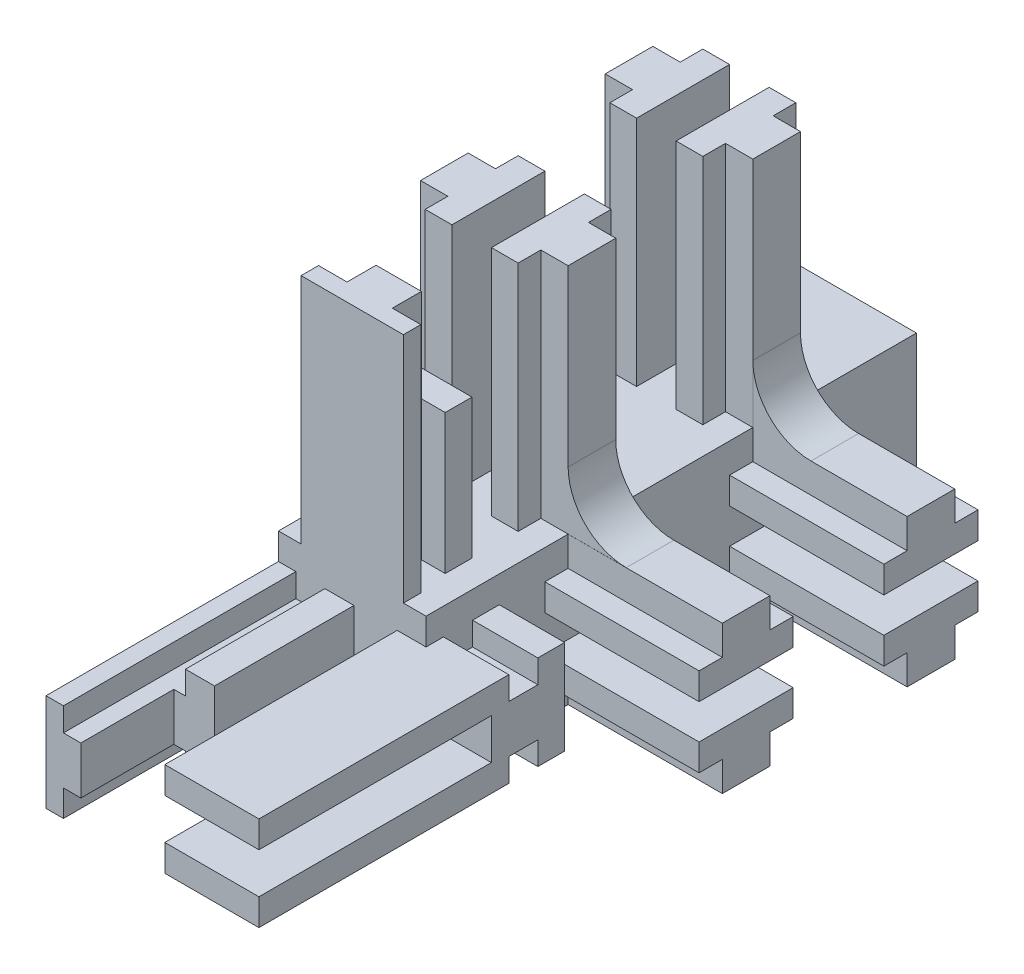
SolidWorks part; units mm, degrees
ref_plane "Front Plane" through (0, 0, 0) normal (0, 0, 1) x (1, 0, 0)
ref_plane "Top Plane" through (0, 0, 0) normal (0, 1, 0) x (1, 0, 0)
ref_plane "Right Plane" through (0, 0, 0) normal (1, 0, 0) x (0, 0, -1)
sketch "Sketch1" plane through (0, 0, 0) normal (0, 0, 1) x (1, 0, 0)
  line L1 (5.4429, 7.3176) -> (-7.2571, 7.3176)
  line L2 (5.4429, 7.3176) -> (5.4429, -5.3824)
  line L3 (5.4429, -5.3824) -> (-7.2571, -5.3824)
  line L4 (-7.2571, 7.3176) -> (-7.2571, -5.3824)
  dimension "D1" = 12.7
  dimension "D2" = 12.7
extrude "Boss-Extrude1" add sketch "Sketch1" along normal blind 44.44
sketch "Sketch4" plane through (0, 7.3176, 0) normal (0, 1, 0) x (1, 0, 0)
  line L0 (1.0429, -42.94) -> (3.4929, -42.94)
  line L2 (5.4429, -22.22) -> (-7.2571, -22.22) construction
  line L3 (5.4429, -44.44) -> (5.4429, 0) construction
  line L4 (1.0429, -1.5) -> (3.0929, -1.5)
  line L5 (-2.6071, -26.165) -> (-2.6071, -34.165)
  line L6 (0.7929, -26.165) -> (0.7929, -34.165)
  line L7 (-7.2571, -16.325) -> (-7.2571, -12.225)
  line L8 (-4.9071, -18.275) -> (-2.6071, -18.275)
  line L9 (-2.6071, -10.275) -> (-4.9071, -10.275)
  line L10 (3.0929, -16.325) -> (3.0929, -18.275)
  line L11 (5.4429, -16.325) -> (5.4429, -12.225)
  line L12 (-4.9071, -34.165) -> (-4.9071, -32.215)
  line L13 (0.7929, -10.275) -> (3.0929, -10.275)
  line L14 (-4.9071, -32.215) -> (-7.2571, -32.215)
  line L15 (3.0929, -16.325) -> (5.4429, -16.325)
  line L16 (-4.9071, -38.14) -> (-4.9071, -40.44)
  line L17 (3.0929, -12.225) -> (5.4429, -12.225)
  line L18 (3.0929, -18.275) -> (0.7929, -18.275)
  line L19 (3.0929, -10.275) -> (3.0929, -12.225)
  line L20 (-4.9071, -26.165) -> (-4.9071, -28.115)
  line L21 (-2.8571, -4) -> (-2.8571, -1.5)
  line L22 (-4.9071, -28.115) -> (-7.2571, -28.115)
  line L23 (1.0429, -4) -> (1.0429, -1.5)
  line L24 (-4.9071, -40.44) -> (-2.8571, -40.44)
  line L25 (-4.9071, -6.3) -> (3.0929, -6.3)
  line L26 (3.0929, -4) -> (3.0929, -6.3)
  line L27 (3.0929, -4) -> (1.0429, -4)
  line L28 (-4.9071, -4) -> (-2.8571, -4)
  line L29 (-4.9071, -16.325) -> (-7.2571, -16.325)
  line L30 (-4.9071, -18.275) -> (-4.9071, -16.325)
  line L31 (-4.9071, -6.3) -> (-4.9071, -4)
  line L32 (3.0929, -40.44) -> (1.0429, -40.44)
  line L33 (3.0929, -40.44) -> (3.0929, -38.14)
  line L34 (-4.9071, -38.14) -> (3.0929, -38.14)
  line L35 (1.0429, -40.44) -> (1.0429, -42.94)
  line L36 (-2.8571, -40.44) -> (-2.8571, -42.94)
  line L37 (3.0929, -34.165) -> (3.0929, -32.215)
  line L38 (-4.9071, -12.225) -> (-7.2571, -12.225)
  line L39 (-7.2571, -44.44) -> (-7.2571, 0) construction
  line L40 (-4.9071, -10.275) -> (-4.9071, -12.225)
  line L41 (0.7929, -18.275) -> (0.7929, -10.275)
  line L42 (3.0929, -26.165) -> (0.7929, -26.165)
  line L43 (3.0929, -32.215) -> (5.4429, -32.215)
  line L44 (-2.6071, -18.275) -> (-2.6071, -10.275)
  line L45 (3.0929, -28.115) -> (5.4429, -28.115)
  line L46 (3.4929, -42.94) -> (3.4929, -44.44)
  line L47 (0.7929, -34.165) -> (3.0929, -34.165)
  line L48 (5.4429, -28.115) -> (5.4429, -32.215)
  line L49 (3.0929, -28.115) -> (3.0929, -26.165)
  line L50 (-2.6071, -34.165) -> (-4.9071, -34.165)
  line L51 (-4.9071, -26.165) -> (-2.6071, -26.165)
  line L52 (-7.2571, -28.115) -> (-7.2571, -32.215)
  line L53 (5.4429, -44.44) -> (-7.2571, -44.44) construction
  line L54 (3.4929, -44.44) -> (-5.3071, -44.44)
  line L55 (-5.3071, -44.44) -> (-5.3071, -42.94)
  line L56 (-5.3071, -42.94) -> (-2.8571, -42.94)
  line L57 (3.0929, -1.5) -> (3.0929, 0)
  line L58 (5.4429, 0) -> (-7.2571, 0) construction
  line L59 (3.0929, 0) -> (-4.9071, 0)
  line L60 (-4.9071, 0) -> (-4.9071, -1.5)
  line L61 (-4.9071, -1.5) -> (-2.8571, -1.5)
  point P0 (-0.9071, 0)
  point P68 (-0.9071, -6.3)
  dimension "D5" = 8
  dimension "D6" = 2.35
  dimension "D7" = 3.975
  dimension "D8" = 2.3
  dimension "D9" = 8
  dimension "D11" = 1.5
  dimension "D12" = 4.1
  dimension "D19" = 2.35
  dimension "D20" = 2.3
  dimension "D23" = 2.3
  dimension "D24" = 8
  dimension "D25" = 4.1
  dimension "D30" = 2.5
extrude "Boss-Extrude3" add sketch "Sketch4" along normal blind 20
sketch "Sketch5" plane through (-7.2571, 0, 0) normal (-1, 0, 0) x (0, 0, 1)
  line L0 (1.5, 3.0176) -> (1.5, 5.0176)
  line L1 (42.94, 3.0176) -> (42.94, 5.0176)
  line L2 (1.5, 5.0176) -> (0, 5.0176)
  line L3 (0, 7.3176) -> (0, -5.3824) construction
  line L4 (0, 5.0176) -> (0, -3.0824)
  line L5 (0, -3.0824) -> (1.5, -3.0824)
  line L6 (16.32, -5.3824) -> (12.22, -5.3824)
  line L7 (18.32, -2.8324) -> (18.32, -0.5324)
  line L8 (10.22, -0.5324) -> (10.22, -2.8324)
  line L9 (16.32, 4.7676) -> (18.32, 4.7676)
  line L10 (16.32, 7.3176) -> (12.22, 7.3176)
  line L11 (1.5, -3.0824) -> (1.5, -1.0824)
  line L12 (10.22, 2.4676) -> (10.22, 4.7676)
  line L13 (42.94, 5.0176) -> (44.44, 5.0176)
  line L14 (16.32, 4.7676) -> (16.32, 7.3176)
  line L15 (44.44, 7.3176) -> (44.44, -5.3824) construction
  line L16 (12.22, 4.7676) -> (12.22, 7.3176)
  line L17 (18.32, 4.7676) -> (18.32, 2.4676)
  line L18 (10.22, 4.7676) -> (12.22, 4.7676)
  line L19 (44.44, 5.0176) -> (44.44, -3.0824)
  line L20 (4, -1.0824) -> (1.5, -1.0824)
  line L21 (44.44, -3.0824) -> (42.94, -3.0824)
  line L22 (4, 3.0176) -> (1.5, 3.0176)
  line L23 (42.94, -3.0824) -> (42.94, -1.0824)
  line L24 (6.3, -3.0824) -> (6.3, 5.0176)
  line L25 (4, 5.0176) -> (6.3, 5.0176)
  line L26 (4, 5.0176) -> (4, 3.0176)
  line L27 (4, -3.0824) -> (4, -1.0824)
  line L28 (16.32, -2.8324) -> (16.32, -5.3824)
  line L29 (18.32, -2.8324) -> (16.32, -2.8324)
  line L30 (6.3, -3.0824) -> (4, -3.0824)
  line L31 (44.44, 7.3176) -> (32.215, 7.3176) construction
  line L32 (4, 27.3176) -> (4, 7.3176) construction
  line L37 (12.22, -2.8324) -> (12.22, -5.3824)
  line L38 (10.22, -2.8324) -> (12.22, -2.8324)
  line L39 (18.32, 2.4676) -> (10.22, 2.4676)
  line L42 (18.32, -0.5324) -> (10.22, -0.5324)
  line L54 (28.115, 7.3176) -> (16.325, 7.3176) construction
  line L55 (22.22, 7.3176) -> (22.22, -5.3824) construction
  line L56 (44.44, -5.3824) -> (0, -5.3824) construction
  line L63 (26.12, -0.5324) -> (34.22, -0.5324)
  line L66 (26.12, 2.4676) -> (34.22, 2.4676)
  line L67 (34.22, -2.8324) -> (32.22, -2.8324)
  line L68 (32.22, -2.8324) -> (32.22, -5.3824)
  line L75 (38.14, -3.0824) -> (40.44, -3.0824)
  line L76 (26.12, -2.8324) -> (28.12, -2.8324)
  line L77 (28.12, -2.8324) -> (28.12, -5.3824)
  line L78 (40.44, -3.0824) -> (40.44, -1.0824)
  line L79 (40.44, 5.0176) -> (40.44, 3.0176)
  line L80 (40.44, 5.0176) -> (38.14, 5.0176)
  line L81 (38.14, -3.0824) -> (38.14, 5.0176)
  line L83 (40.44, 3.0176) -> (42.94, 3.0176)
  line L85 (40.44, -1.0824) -> (42.94, -1.0824)
  line L87 (34.22, 4.7676) -> (32.22, 4.7676)
  line L88 (26.12, 4.7676) -> (26.12, 2.4676)
  line L89 (32.22, 4.7676) -> (32.22, 7.3176)
  line L91 (28.12, 4.7676) -> (28.12, 7.3176)
  line L93 (34.22, 2.4676) -> (34.22, 4.7676)
  line L95 (28.12, 7.3176) -> (32.22, 7.3176)
  line L96 (28.12, 4.7676) -> (26.12, 4.7676)
  line L97 (34.22, -0.5324) -> (34.22, -2.8324)
  line L98 (26.12, -2.8324) -> (26.12, -0.5324)
  line L99 (28.12, -5.3824) -> (32.22, -5.3824)
  dimension "D1" = 4.1
  dimension "D3" = 3
  dimension "D4" = 2.55
  dimension "D5" = 1.5
  dimension "D6" = 2.3
  dimension "D7" = 8.1
  dimension "D8" = 2.3
  dimension "D9" = 3.9
  dimension "D10" = 8.1
  dimension "D11" = 4.1
  dimension "D12" = 4.1
  dimension "D13" = 2.3
  dimension "D16" = 8.1
  dimension "D19" = 2.3
  dimension "D21" = 2.5
extrude "Boss-Extrude4" add sketch "Sketch5" along normal blind 31.74
sketch "Sketch6" plane through (0, 0, 0) normal (0, 0, -1) x (-1, 0, 0)
  line L0 (-6.6534, 2.2662) -> (-8.5879, 2.2662) construction
  line L2 (-5.4429, -5.3824) -> (-5.4429, 7.3176) construction
  line L14 (1.8572, 5.4581) -> (-1.4428, 5.4581)
  line L22 (-1.4428, 5.4581) -> (-1.4429, 3.3581)
  line L30 (-1.4428, -3.5228) -> (-1.4429, -1.4228)
  line L31 (-1.4428, -3.5228) -> (1.8572, -3.5228)
  line L32 (1.8572, 5.4581) -> (1.8572, -3.5228)
  line L33 (-1.4429, -1.4228) -> (-3.4429, -1.4324)
  line L34 (-1.4429, 3.3581) -> (-3.4429, 3.3676)
  line L50 (-3.4429, -1.4324) -> (-3.4429, 3.3676)
  point P2 (-3.4429, 0.9676)
  point P8 (-5.4429, 0.9676)
  dimension "D1" = 2
  dimension "D2" = 4.8
  dimension "D3" = 3.3
  dimension "D4" = 3.3
extrude "Boss-Extrude5" add sketch "Sketch6" along normal blind 20
sketch "Sketch7" [suppressed] plane through (3.4429, 0, 0) normal (1, 0, 0) x (0, 0, -1)
  line L0 (-32.565, 27.3176) -> (-27.965, 27.3176) construction
  line L1 (-16.475, 27.3176) -> (-11.875, 27.3176) construction
  line L2 (20, 3.3676) -> (20, -1.4324) construction
  circle A0 centre (16, 0.9676) radius 2.1
  circle A1 centre (6, 0.9676) radius 2.1
  circle A2 centre (-14.175, 23.3176) radius 2.1
  circle A3 centre (-14.175, 13.3176) radius 2.1
  circle A4 centre (-30.265, 23.3176) radius 2.1
  circle A5 centre (-30.265, 13.3176) radius 2.1
  dimension "D1" = 4.2
  dimension "D2" = 4.2
  dimension "D3" = 4.2
  dimension "D4" = 4.2
  dimension "D5" = 4.2
  dimension "D6" = 4.2
  dimension "D7" = 4
  dimension "D8" = 4
  dimension "D9" = 4
  dimension "D10" = 10
  dimension "D11" = 10
  dimension "D12" = 10
extrude "Cut-Extrude1" [suppressed] cut sketch "Sketch7" against normal through all both and the other way through all
sketch "Sketch8" plane through (0, 7.3176, 0) normal (0, 1, 0) x (1, 0, 0)
  line L0 (-38.9971, -16.32) -> (-38.9971, -12.22) construction
  line L2 (-38.9971, -32.22) -> (-38.9971, -28.12) construction
  circle A0 centre (-30.9971, -14.27) radius 2.1
  circle A1 centre (-20.9971, -14.27) radius 2.1
  circle A2 centre (-30.9971, -30.17) radius 2.1
  circle A3 centre (-20.9971, -30.17) radius 2.1
  point P5 (-38.9971, -14.27)
  point P16 (-38.9971, -30.17)
  dimension "D1" = 4.2
  dimension "D4" = 4.2
  dimension "D5" = 4.2
  dimension "D6" = 10
  dimension "D3" = 4.2
  dimension "D2" = 8
  dimension "D7" = 8
  dimension "D8" = 10
extrude "Cut-Extrude2" [suppressed] cut sketch "Sketch8" against normal through all both and the other way through all
sketch "Sketch9" plane through (5.4429, 0, 0) normal (1, 0, 0) x (0, 0, -1)
  line L1 (0, 5.4581) -> (20, 5.4581)
  line L2 (0, 5.4581) -> (0, -3.5228)
  line L3 (0, -3.5228) -> (20, -3.5228)
  line L4 (20, 5.4581) -> (20, -3.5228)
extrude "Cut-Extrude3" cut sketch "Sketch9" against normal through all
sketch "Sketch11" plane through (0, 0, 44.44) normal (0, 0, 1) x (1, 0, 0)
  line L0 (4.6313, 1.3536) -> (6.5657, 1.3536) construction
  line L1 (3.9429, 3.0176) -> (3.9429, 5.0397)
  line L2 (-16.7771, 7.3036) -> (-16.7771, -5.3964) construction
  line L3 (-12.8771, -0.7824) -> (-4.7771, -0.7824)
  line L4 (-12.8771, 2.7176) -> (-4.7771, 2.7176)
  line L5 (-38.9971, -3.0824) -> (-7.2571, -3.0824) construction
  line L6 (-20.6771, -3.0824) -> (-20.6771, -0.7824)
  line L7 (-28.7771, -0.7824) -> (-28.7771, -3.0824)
  line L8 (-28.7771, -3.0824) -> (-20.6771, -3.0824)
  line L9 (-28.7771, 5.0176) -> (-20.6771, 5.0176)
  line L11 (-28.7771, 2.7176) -> (-28.7771, 5.0176)
  line L13 (-12.8771, 5.0176) -> (-4.7771, 5.0176)
  line L14 (-1.0571, -3.0824) -> (1.4429, -3.0824)
  line L15 (-12.8771, -3.0824) -> (-4.7771, -3.0824)
  line L16 (-20.6771, 5.0176) -> (-20.6771, 2.7176)
  line L17 (-38.9971, 5.0176) -> (-7.2571, 5.0176) construction
  line L19 (-34.9971, -1.0824) -> (-37.4971, -1.0824)
  line L20 (-37.4971, 3.0176) -> (-37.4971, 5.0176)
  line L21 (-34.9971, 3.0176) -> (-37.4971, 3.0176)
  line L22 (1.4429, -3.0824) -> (1.4429, -1.0824)
  line L23 (-32.4971, -3.0824) -> (-32.4971, 5.0176)
  line L24 (-34.9971, 5.0176) -> (-32.4971, 5.0176)
  line L25 (-34.9971, 5.0176) -> (-34.9971, 3.0176)
  line L26 (-34.9971, -3.0824) -> (-34.9971, -1.0824)
  line L27 (-37.4971, 5.0176) -> (-38.9971, 5.0176)
  line L28 (-38.9971, 5.0176) -> (-38.9971, -3.0824)
  line L29 (-32.4971, -3.0824) -> (-34.9971, -3.0824)
  line L30 (1.4429, 5.0176) -> (1.4429, 3.0176)
  line L31 (1.4429, 5.0176) -> (-1.0571, 5.0176)
  line L32 (-1.0571, -3.0824) -> (-1.0571, 5.0176)
  line L33 (1.4429, 3.0176) -> (3.9429, 3.0176)
  line L34 (1.4429, -1.0824) -> (3.9429, -1.0824)
  line L35 (-38.9971, -3.0824) -> (-37.4971, -3.0824)
  line L36 (-37.4971, -3.0824) -> (-37.4971, -1.0824)
  line L37 (3.9429, 5.0397) -> (5.4429, 5.0397)
  line L38 (-20.6771, 2.7176) -> (-28.7771, 2.7176)
  line L39 (-12.8771, 5.0176) -> (-12.8771, 2.7176)
  line L40 (5.4429, 5.0397) -> (5.4429, -3.3603)
  line L41 (-20.6771, -0.7824) -> (-28.7771, -0.7824)
  line L42 (5.4429, -3.3603) -> (3.9429, -3.3603)
  line L44 (-4.7771, 2.7176) -> (-4.7771, 5.0176)
  line L45 (3.9429, -3.3603) -> (3.9429, -1.0824)
  line L47 (-4.7771, -0.7824) -> (-4.7771, -3.0824)
  line L48 (-12.8771, -3.0824) -> (-12.8771, -0.7824)
  line L49 (5.4429, -5.3824) -> (5.4429, 7.3176) construction
  point P0 (-16.7771, 0.9536)
  dimension "D3" = 2.3
  dimension "D4" = 3.5
  dimension "D6" = 3.9
  dimension "D7" = 8.1
  dimension "D8" = 2.3
  dimension "D9" = 1.5
  dimension "D10" = 8.1
  dimension "D11" = 1.5
  dimension "D12" = 22.22
  dimension "D13" = 22.22
  dimension "D15" = 2
  dimension "D16" = 8.1
  dimension "D17" = 1.5
  dimension "D19" = 2.5
  dimension "D20" = 2.5
  dimension "D21" = 2.5
extrude "Boss-Extrude6" add sketch "Sketch11" along normal blind 20
sketch "Sketch14" plane through (-38.9971, 0, 0) normal (-1, 0, 0) x (0, 0, 1)
  line L0 (44.44, 7.3176) -> (32.22, 7.3176) construction
  line L1 (42.67, 7.3176) -> (0, 7.3176)
  line L2 (42.67, 7.3176) -> (42.67, -5.3824)
  line L3 (42.67, -5.3824) -> (0, -5.3824)
  line L4 (0, 7.3176) -> (0, -5.3824)
extrude "Cut-Extrude4" [suppressed] cut sketch "Sketch14" against normal through all
sketch "Sketch15" plane through (0, 5.0176, 0) normal (0, 1, 0) x (1, 0, 0)
  line L0 (-4.7771, -64.44) -> (-12.8771, -64.44) construction
  line L1 (-20.6771, -64.44) -> (-28.7771, -64.44) construction
  circle A0 centre (-8.8271, -60.44) radius 2.1
  circle A1 centre (-8.8271, -50.44) radius 2.1
  circle A2 centre (-24.7271, -60.44) radius 2.1
  circle A3 centre (-24.7271, -50.44) radius 2.1
  point P12 (-24.7271, -64.44)
  point P13 (-8.8271, -64.44)
  dimension "D1" = 4.2
  dimension "D2" = 4.2
  dimension "D3" = 4.2
  dimension "D4" = 4.2
  dimension "D5" = 4
  dimension "D6" = 10
  dimension "D7" = 4
  dimension "D8" = 10
extrude "Cut-Extrude5" [suppressed] cut sketch "Sketch15" against normal blind 30
sketch "Sketch17" plane through (-7.2571, 0, 0) normal (-1, 0, 0) x (0, 0, 1)
  line L0 (12.225, 27.3176) -> (16.325, 27.3176) construction
  line L1 (28.115, 27.3176) -> (32.215, 27.3176) construction
  circle A0 centre (14.275, 23.3176) radius 2.1
  circle A1 centre (14.275, 13.3176) radius 2.1
  circle A2 centre (30.165, 23.3176) radius 2.1
  circle A3 centre (30.165, 13.3176) radius 2.1
  point P13 (30.165, 27.3176)
  point P14 (14.275, 27.3176)
  dimension "D1" = 4.2
  dimension "D2" = 4.2
  dimension "D3" = 4.2
  dimension "D4" = 4.2
  dimension "D5" = 4
  dimension "D6" = 4
  dimension "D7" = 10
  dimension "D8" = 10
extrude "Cut-Extrude6" [suppressed] cut sketch "Sketch17" against normal blind 30
sketch "Sketch18" plane through (-38.9971, 0, 0) normal (-1, 0, 0) x (0, 0, 1)
  line L0 (4, -3.0824) -> (6.3, -3.0824) construction
  line L1 (3, 5.0176) -> (6.3, 5.0176)
  line L2 (3, 5.0176) -> (3, -3.0824)
  line L3 (3, -3.0824) -> (6.3, -3.0824)
  line L4 (6.3, 5.0176) -> (6.3, -3.0824)
  line L7 (1.5, 3.0176) -> (1.5, 5.0176) construction
  dimension "D1" = 1.5
extrude "Cut-Extrude7" cut sketch "Sketch18" against normal blind 8
sketch "Sketch19" plane through (0, 27.3176, 0) normal (0, 1, 0) x (1, 0, 0)
  line L1 (3.0929, -4) -> (-4.9071, -4)
  line L2 (3.0929, -4) -> (3.0929, -6.3)
  line L3 (3.0929, -6.3) -> (-4.9071, -6.3)
  line L4 (-4.9071, -4) -> (-4.9071, -6.3)
  line L5 (3.0929, -38.14) -> (-4.9071, -38.14)
  line L6 (3.0929, -38.14) -> (3.0929, -40.44)
  line L7 (3.0929, -40.44) -> (-4.9071, -40.44)
  line L8 (-4.9071, -38.14) -> (-4.9071, -40.44)
extrude "Cut-Extrude8" cut sketch "Sketch19" against normal blind 8
sketch "Sketch20" plane through (-38.9971, 0, 0) normal (-1, 0, 0) x (0, 0, 1)
  line L0 (42.94, -1.0824) -> (42.94, -3.3603)
  line L1 (42.94, 5.0176) -> (44.44, 5.0176)
  line L2 (42.94, 5.0176) -> (42.94, 3.1397)
  line L3 (42.94, -3.3603) -> (44.44, -3.3603)
  line L4 (44.44, 5.0176) -> (44.44, -3.3603)
  line L5 (41.44, 3.1397) -> (42.94, 3.1397)
  line L6 (41.44, 3.1397) -> (41.44, -1.0824)
  line L7 (41.44, -1.0824) -> (42.94, -1.0824)
  dimension "D1" = 1.5
extrude "Boss-Extrude7" [suppressed] add sketch "Sketch20" along normal blind 8
sketch "Sketch21" plane through (0, 0, 64.44) normal (0, 0, 1) x (1, 0, 0)
  line L0 (-35.9971, 3.2397) -> (-36.0266, -3.378)
  line L1 (-32.4971, 5.0176) -> (-35.9971, 5.0176)
  line L2 (-32.4971, 5.0176) -> (-32.4971, -3.378)
  line L3 (-32.4971, -3.378) -> (-36.0266, -3.378)
  line L4 (-35.9971, 5.0176) -> (-35.9971, 3.2397)
  line L5 (2.4429, 5.0397) -> (-1.0571, 5.0397)
  line L6 (2.4429, 5.0397) -> (2.4429, -1.5603)
  line L7 (2.1429, -3.0824) -> (-1.0571, -3.0824)
  line L8 (-1.0571, 5.0397) -> (-1.0571, -3.0824)
  line L10 (3.9429, 5.0397) -> (3.9429, 3.0176) construction
  line L11 (-37.4971, 3.0176) -> (-37.4971, 5.0176) construction
  line L12 (2.4429, -1.5603) -> (2.1429, -3.0824)
  dimension "D1" = 1.5
  dimension "D2" = 1.5
  dimension "D3" = 1.5
extrude "Cut-Extrude9" cut sketch "Sketch21" against normal blind 8
hole_wizard "CSK for M2.5 Cross Recess Flat Head Screw1" positions "Sketch22" profile "Sketch24" countersink size "M2.5" standard "IS"
sketch "Sketch22" plane through (0, 0, 0) normal (0, 0, -1) x (-1, 0, 0)
  line L0 (-3.0929, 27.3176) -> (4.9071, 27.3176) construction
  line L1 (38.9971, 5.0176) -> (38.9971, -3.0824) construction
  point P0 (33.9971, 0.8397)
  point P6 (0.9071, 22.3176)
  dimension "D1" = 5
  dimension "D2" = 5
sketch "Sketch24" plane through (-33.9971, 0.8397, 0) normal (1, 0, 0) x (0, 1, 0)
  line L0 (0, 0) -> (0, 5.9313)
  line L1 (0, 5.9313) -> (1.55, 5)
  line L2 (1.55, 5) -> (1.55, 1.2)
  line L3 (1.55, 1.2) -> (2.75, 0)
  line L5 (2.75, 0) -> (0, 0)
  line L6 (-1.55, 1.2) -> (-2.75, 0) construction
  line L10 (0, 5.9313) -> (-1.55, 5) construction
  line L11 (0, -6.35) -> (0, 107.95) construction
  dimension "Hole Dia." = 3.1
  dimension "Hole Depth" = 5
  dimension "Near C'Sink Dia." = 5.5
  dimension "Near C'Sink Angle" = 90
  dimension "Drill Angle" = 118
hole_wizard "CSK for M2.5 Cross Recess Flat Head Screw2" positions "Sketch25" profile "Sketch26" countersink size "M2.5" standard "IS"
sketch "Sketch25" [suppressed] plane through (0, 0, 44.44) normal (0, 0, 1) x (1, 0, 0)
  line L0 (-46.9971, -3.3603) -> (-46.9971, 5.0397) construction
  line L1 (-5.3071, 27.3176) -> (3.4929, 27.3176) construction
  point P0 (-41.9971, 0.8397)
  point P2 (-0.9071, 22.3176)
  dimension "D1" = 5
  dimension "D2" = 5
sketch "Sketch26" plane through (-41.9971, 0.8397, 44.44) normal (1, 0, 0) x (0, -1, 0)
  line L0 (0, 0) -> (0, 5.9313)
  line L1 (0, 5.9313) -> (1.55, 5)
  line L2 (1.55, 5) -> (1.55, 1.2)
  line L3 (1.55, 1.2) -> (2.75, 0)
  line L5 (2.75, 0) -> (0, 0)
  line L6 (-1.55, 1.2) -> (-2.75, 0) construction
  line L10 (0, 5.9313) -> (-1.55, 5) construction
  line L11 (0, -6.35) -> (0, 107.95) construction
  dimension "Hole Dia." = 3.1
  dimension "Hole Depth" = 5
  dimension "Near C'Sink Dia." = 5.5
  dimension "Near C'Sink Angle" = 90
  dimension "Drill Angle" = 118
hole_wizard "CSK for M2.5 Cross Recess Flat Head Screw3" positions "Sketch27" profile "Sketch28" countersink size "M2.5" standard "IS"
sketch "Sketch27" plane through (5.4429, 0, 0) normal (1, 0, 0) x (0, 0, -1)
  line L0 (-64.44, -3.3603) -> (-64.44, 5.0397) construction
  point P0 (-59.44, 0.8397)
  dimension "D1" = 5
sketch "Sketch28" plane through (5.4429, 0.8397, 59.44) normal (0, 1, 0) x (0, 0, -1)
  line L0 (0, 0) -> (0, 5.9313)
  line L1 (0, 5.9313) -> (1.55, 5)
  line L2 (1.55, 5) -> (1.55, 1.2)
  line L3 (1.55, 1.2) -> (2.75, 0)
  line L5 (2.75, 0) -> (0, 0)
  line L6 (-1.55, 1.2) -> (-2.75, 0) construction
  line L10 (0, 5.9313) -> (-1.55, 5) construction
  line L11 (0, -6.35) -> (0, 107.95) construction
  dimension "Hole Dia." = 3.1
  dimension "Hole Depth" = 5
  dimension "Near C'Sink Dia." = 5.5
  dimension "Near C'Sink Angle" = 90
  dimension "Drill Angle" = 118
hole_wizard "CSK for M2.5 Cross Recess Flat Head Screw4" positions "Sketch29" profile "Sketch30" countersink size "M2.5" standard "IS"
sketch "Sketch29" plane through (-38.9971, 0, 0) normal (-1, 0, 0) x (0, 0, 1)
  line L0 (64.44, 5.0176) -> (64.44, -3.0824) construction
  point P0 (59.44, 0.8397)
  dimension "D1" = 5
sketch "Sketch30" plane through (-38.9971, 0.8397, 59.44) normal (0, 1, 0) x (0, 0, 1)
  line L0 (0, 0) -> (0, 5.9313)
  line L1 (0, 5.9313) -> (1.55, 5)
  line L2 (1.55, 5) -> (1.55, 1.2)
  line L3 (1.55, 1.2) -> (2.75, 0)
  line L5 (2.75, 0) -> (0, 0)
  line L6 (-1.55, 1.2) -> (-2.75, 0) construction
  line L10 (0, 5.9313) -> (-1.55, 5) construction
  line L11 (0, -6.35) -> (0, 107.95) construction
  dimension "Hole Dia." = 3.1
  dimension "Hole Depth" = 5
  dimension "Near C'Sink Dia." = 5.5
  dimension "Near C'Sink Angle" = 90
  dimension "Drill Angle" = 118
sketch "Sketch31" plane through (-37.4971, 0, 0) normal (1, 0, 0) x (0, 0, -1)
  circle A0 centre (-59.44, 0.8397) radius 2
  dimension "D1" = 4
extrude "Cut-Extrude10" [suppressed] cut sketch "Sketch31" against normal blind 8 and the other way up to surface
sketch "Sketch32" [suppressed] plane through (3.9429, 0, 0) normal (-1, 0, 0) x (0, 0, 1)
  circle A0 centre (59.44, 0.8397) radius 2
  dimension "D1" = 4
extrude "Cut-Extrude11" [suppressed] cut sketch "Sketch32" against normal blind 8 and the other way up to surface
sketch "Sketch33" [suppressed] plane through (0, 0, 41.145) normal (0, 0, -1) x (-1, 0, 0)
  circle A0 centre (41.9971, 0.8397) radius 2
  dimension "D1" = 4
extrude "Cut-Extrude12" [suppressed] cut sketch "Sketch33" against normal blind 8
sketch "Sketch34" plane through (0, 0, 3) normal (0, 0, 1) x (1, 0, 0)
  circle A0 centre (-33.9971, 0.8397) radius 2
  dimension "D1" = 4
extrude "Cut-Extrude13" [suppressed] cut sketch "Sketch34" against normal blind 8
sketch "Sketch35" plane through (0, 0, 4) normal (0, 0, 1) x (1, 0, 0)
  circle A0 centre (-0.9071, 22.3176) radius 2
  dimension "D1" = 4
extrude "Cut-Extrude14" [suppressed] cut sketch "Sketch35" against normal blind 8
sketch "Sketch36" [suppressed] plane through (0, 0, 40.695) normal (0, 0, -1) x (-1, 0, 0)
  circle A0 centre (0.9071, 22.3176) radius 2
  dimension "D1" = 4
extrude "Cut-Extrude15" [suppressed] cut sketch "Sketch36" against normal blind 8
sketch "Sketch37" plane through (5.4429, 0, 0) normal (1, 0, 0) x (0, 0, -1)
  line L0 (0, -5.3824) -> (0, 7.3176) construction
  line L1 (-44.44, 7.3176) -> (-32.215, 7.3176) construction
  circle A0 centre (-22.22, 0.9676) radius 2
  dimension "D1" = 4
  dimension "D2" = 22.22
  dimension "D3" = 6.35
extrude "Cut-Extrude16" [suppressed] cut sketch "Sketch37" against normal through all
hole_wizard "CSK for M3 Cross Recess Flat Head Screw5" positions "Sketch38" profile "Sketch39" countersink size "M3" standard "IS"
sketch "Sketch38" [suppressed] plane through (5.4429, 0, 0) normal (1, 0, 0) x (0, 0, -1)
  point P0 (-22.22, 0.9676)
sketch "Sketch39" plane through (5.4429, 0.9676, 22.22) normal (0, 1, 0) x (0, 0, -1)
  line L0 (0, 0) -> (0, 6.0815)
  line L1 (0, 6.0815) -> (1.8, 5)
  line L2 (1.8, 5) -> (1.8, 1.35)
  line L3 (1.8, 1.35) -> (3.15, 0)
  line L5 (3.15, 0) -> (0, 0)
  line L6 (-1.8, 1.35) -> (-3.15, 0) construction
  line L10 (0, 6.0815) -> (-1.8, 5) construction
  line L11 (0, -6.35) -> (0, 107.95) construction
  dimension "Hole Dia." = 3.6
  dimension "Hole Depth" = 5
  dimension "Near C'Sink Dia." = 6.3
  dimension "Near C'Sink Angle" = 90
  dimension "Drill Angle" = 118
sketch "Sketch40" plane through (0, 27.3176, 0) normal (0, 1, 0) x (1, 0, 0)
  line L0 (-41.7979, -20.7337) -> (-49.005, -20.7337)
  line L1 (9.853, -20.7337) -> (-17.624, -20.7337)
  line L2 (9.853, -20.7337) -> (9.853, -66.0784)
  line L3 (9.853, -66.0784) -> (-49.005, -66.0784)
  line L4 (-49.005, -20.7337) -> (-49.005, -66.0784)
  line L6 (-17.624, -20.7337) -> (-17.624, 2.5393)
  line L7 (-17.624, 2.5393) -> (-41.7979, 2.5393)
  line L8 (-41.7979, -20.7337) -> (-41.7979, 2.5393)
extrude "Cut-Extrude17" [suppressed] cut sketch "Sketch40" against normal through all
fillet "Fillet4" [suppressed] radius 5
sketch "Sketch42" plane through (0, 27.3176, 0) normal (0, 1, 0) x (1, 0, 0)
  line L0 (5.4429, -44.44) -> (5.4429, -32.215) construction
  line L1 (5.4429, 0) -> (-38.9971, 0)
  line L2 (5.4429, 0) -> (5.4429, -7.045)
  line L3 (5.4429, -7.045) -> (-38.9971, -7.045)
  line L4 (-38.9971, 0) -> (-38.9971, -7.045)
extrude "Cut-Extrude18" cut sketch "Sketch42" against normal through all and the other way through all
sketch "Sketch43" plane through (0, 0, 7.045) normal (0, 0, -1) x (-1, 0, 0)
  line L6 (-5.4429, 7.3176) -> (-5.4429, -5.3824)
  line L7 (-5.4429, -5.3824) -> (7.2571, -5.3824)
  line L8 (7.2571, -5.3824) -> (7.2571, 7.3176)
  line L11 (7.2571, 7.3176) -> (-5.4429, 7.3176)
  line L12 (-5.4429, 7.3176) -> (-5.4429, -5.3824)
  line L13 (-5.4429, -5.3824) -> (7.2571, -5.3824)
  line L14 (7.2571, -5.3824) -> (7.2571, 7.3176)
  line L17 (7.2571, 7.3176) -> (-5.4429, 7.3176)
  dimension "D1" = 0
extrude "Boss-Extrude10" add sketch "Sketch43" along normal blind 4.8
sketch "Sketch45" plane through (0, 7.3176, 0) normal (0, 1, 0) x (1, 0, 0)
  line L1 (-28.9271, -44.44) -> (-20.6771, -44.44)
  line L2 (-28.9271, -44.44) -> (-28.9271, -64.44)
  line L3 (-28.9271, -64.44) -> (-20.6771, -64.44)
  line L4 (-20.6771, -44.44) -> (-20.6771, -64.44)
  line L5 (-38.9971, -34.22) -> (-7.2571, -34.22) construction
  line L6 (-20.5271, -34.22) -> (-38.9971, -34.22)
  line L7 (-20.5271, -34.22) -> (-20.5271, -10.22)
  line L8 (-20.5271, -10.22) -> (-38.9971, -10.22)
  line L9 (-38.9971, -34.22) -> (-38.9971, -10.22)
  line L10 (-20.6771, -64.44) -> (-20.6771, -44.44) construction
extrude "Cut-Extrude19" cut sketch "Sketch45" against normal through all
sketch "Sketch46" plane through (0, 0, 44.44) normal (0, 0, 1) x (1, 0, 0)
  line L1 (-12.8771, 9.7968) -> (-42.2317, 9.7968)
  line L2 (-12.8771, 9.7968) -> (-12.8771, -6.9006)
  line L3 (-12.8771, -6.9006) -> (-42.2317, -6.9006)
  line L4 (-42.2317, 9.7968) -> (-42.2317, -6.9006)
  line L5 (-12.8771, 5.0176) -> (-12.8771, 2.7176) construction
extrude "Cut-Extrude21" cut sketch "Sketch46" against normal up to surface and the other way up to surface
ref_plane "Plane1" through (7.7429, 0, 0) normal (1, 0, 0) x (0, 0, -1)
mirror "Mirror2" about plane through (7.7429, 0, 0) normal (1, 0, 0)
sketch "Sketch47" plane through (5.4429, 0, 0) normal (1, 0, 0) x (0, 0, -1)
  line L1 (4.6204, 33.5395) -> (-76.64, 33.5395)
  line L2 (4.6204, 33.5395) -> (4.6204, -12.9836)
  line L3 (4.6204, -12.9836) -> (-76.64, -12.9836)
  line L4 (-76.64, 33.5395) -> (-76.64, -12.9836)
extrude "Cut-Extrude22" cut sketch "Sketch47" against normal through all
ref_plane "Plane2" through (0, 0, 5.245) normal (0, 0, -1) x (-1, 0, 0)
sketch "Sketch48" plane through (0, 0, 5.245) normal (0, 0, -1) x (-1, 0, 0)
  line L0 (-10.0429, 7.3176) -> (-10.0429, -5.3824) construction
  line L1 (-13.0429, -2.3824) -> (-19.7429, -2.3824)
  line L2 (-13.0429, -2.3824) -> (-13.0429, 4.3176)
  line L3 (-13.0429, 4.3176) -> (-19.7429, 4.3176)
  line L4 (-19.7429, -2.3824) -> (-19.7429, 4.3176)
  line L5 (-10.0429, -5.3824) -> (-22.7429, -5.3824) construction
  line L6 (-22.7429, 7.3176) -> (-10.0429, 7.3176) construction
  line L7 (-22.7429, -5.3824) -> (-22.7429, 7.3176) construction
  dimension "D1" = 3
  dimension "D2" = 3
  dimension "D3" = 3
  dimension "D4" = 3
extrude "Cut-Extrude23" cut sketch "Sketch48" against normal blind 36
fillet "Fillet5" radius 5 2 edges at (22.7429, 7.3176, 14.2725) (22.7429, 7.3176, 30.1675)
